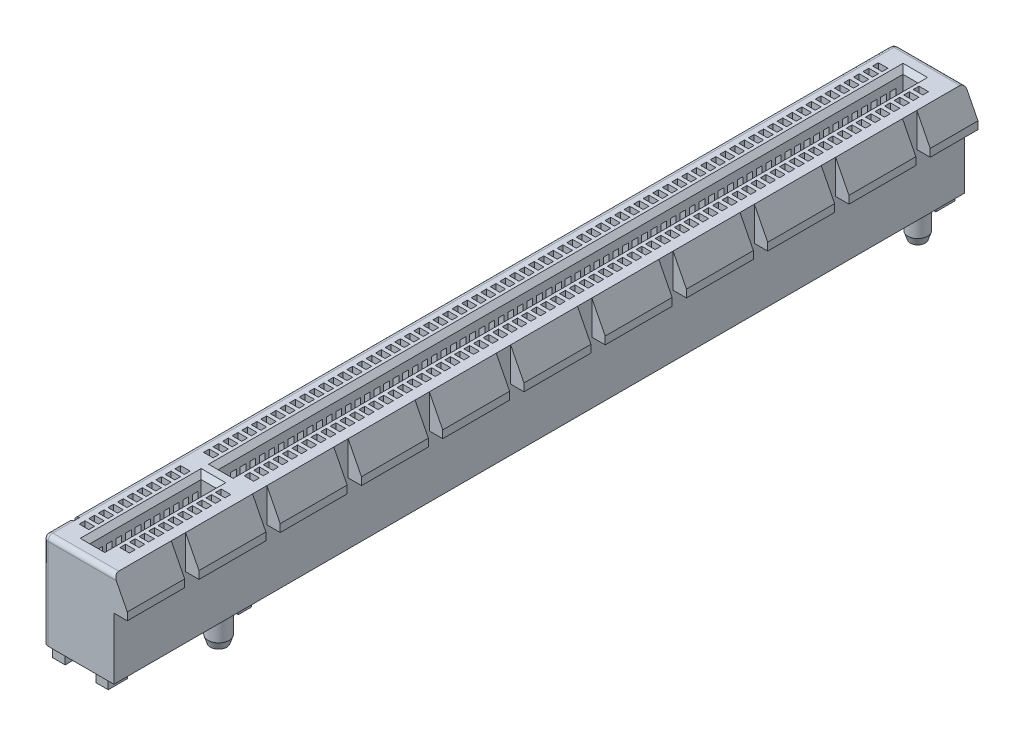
SolidWorks part; units mm, degrees
ref_plane "Front" through (0, 0, 0) normal (0, 0, 1) x (1, 0, 0)
ref_plane "Top" through (0, 0, 0) normal (0, 1, 0) x (1, 0, 0)
ref_plane "Right" through (0, 0, 0) normal (1, 0, 0) x (0, 0, -1)
sketch "Sketch1" plane through (0, 0, 0) normal (0, 0, 1) x (1, 0, 0)
  line L0 (-3.7, 0) -> (3.7, 0)
  line L2 (3.7, 10) -> (-3.7, 10)
  line L6 (-3.7, 10) -> (-3.7, 0)
  line L7 (3.7, 10) -> (5.1, 7.25)
  line L8 (5.1, 7.25) -> (5.1, 6.45)
  line L9 (5.1, 6.45) -> (3.7, 6.45)
  line L10 (3.7, 6.45) -> (3.7, 0)
  dimension "D1" = 7.4
  dimension "D2" = 10
  dimension "D7" = 0.8
  dimension "D8" = 5.1
  dimension "D9" = 3.7
  dimension "D10" = 3.55
extrude "Body Extrude" add sketch "Sketch1" along normal blind 89
sketch "Datum Reference" plane through (0, 10, 0) normal (0, 1, 0) x (1, 0, 0)
  line L0 (-3.7, -74.5) -> (5.1, -74.5)
  line L1 (-3.7, -89) -> (-3.7, 0) construction
  line L2 (5.1, -89) -> (5.1, 0) construction
  line L3 (3.7, -89) -> (-3.7, -89) construction
  line L4 (0, -89) -> (0, 0)
  dimension "D1" = 14.5
sketch "Sketch3" plane through (0, 10, 0) normal (0, 1, 0) x (1, 0, 0)
  line L1 (0, -89) -> (0, 0) construction
  line L2 (-3.7, -74.5) -> (5.1, -74.5) construction
  line L3 (-0.785, -87.04) -> (0.785, -87.04)
  line L4 (-0.785, -87.04) -> (-0.785, -75.39)
  line L5 (-0.785, -75.39) -> (0.785, -75.39)
  line L6 (0.785, -87.04) -> (0.785, -75.39)
  line L7 (-0.785, -87.04) -> (0.785, -75.39) construction
  line L8 (-0.785, -75.39) -> (0.785, -87.04) construction
  line L9 (-0.785, -73.61) -> (0.785, -73.61)
  line L10 (-0.785, -73.61) -> (-0.785, -1.96)
  line L11 (-0.785, -1.96) -> (0.785, -1.96)
  line L12 (0.785, -73.61) -> (0.785, -1.96)
  line L13 (-0.785, -73.61) -> (0.785, -1.96) construction
  line L14 (-0.785, -1.96) -> (0.785, -73.61) construction
  line L16 (3.7, 0) -> (-3.7, 0) construction
  point P1 (0, -81.215)
  point P7 (0, -37.785)
  dimension "D1" = 0.89
  dimension "D2" = 1.78
  dimension "D3" = 11.65
  dimension "D4" = 1.96
  dimension "D5" = 1.57
extrude "PCB Slot" cut sketch "Sketch3" against normal offset from surface (7.6 mm away) 4.05
sketch "Sketch4" plane through (0, 10, 0) normal (0, 1, 0) x (1, 0, 0)
  line L1 (1.625, -85.7) -> (2.625, -85.7)
  line L2 (1.625, -85.7) -> (1.625, -86.3)
  line L3 (1.625, -86.3) -> (2.625, -86.3)
  line L4 (2.625, -85.7) -> (2.625, -86.3)
  line L5 (-2.625, -85.7) -> (-1.625, -85.7)
  line L6 (-2.625, -85.7) -> (-2.625, -86.3)
  line L7 (-2.625, -86.3) -> (-1.625, -86.3)
  line L8 (-1.625, -85.7) -> (-1.625, -86.3)
  line L9 (0, -74.5) -> (0, -89) construction
  line L10 (-3.7, -74.5) -> (5.1, -74.5) construction
  line L11 (0, -89) -> (0, 0) construction
  line L12 (1.625, -85.7) -> (2.625, -86.3) construction
  line L14 (2.625, -85.7) -> (1.625, -86.3) construction
  point P15 (2.125, -86)
  dimension "D1" = 11.5
  dimension "D2" = 3.25
  dimension "D3" = 0.6
  dimension "D4" = 5.25
extrude "Pin Holder (Top)" cut sketch "Sketch4" against normal blind 4.75
sketch "Sketch7" plane through (0, 10, 0) normal (0, 1, 0) x (1, 0, 0)
  line L0 (-3.7, -89) -> (-3.7, 0) construction
  line L1 (-1.625, -85.7) -> (-2.625, -85.7) construction
  line L2 (-3.2, -85.7) -> (-3.7, -85.7)
  line L3 (-3.2, -85.7) -> (-3.2, -86.3)
  line L4 (-3.2, -86.3) -> (-3.7, -86.3)
  line L5 (-3.7, -85.7) -> (-3.7, -86.3)
  line L6 (-2.625, -86.3) -> (-1.625, -86.3) construction
  dimension "D1" = 0.5
extrude "Cut-Extrude4" cut sketch "Sketch7" against normal up to surface (4.75 mm away)
ref_plane "Upper Face - 1.4mm" through (0, 8.6, 0) normal (0, 1, 0) x (1, 0, 0)
sketch "Sketch5" plane through (0, 8.6, 0) normal (0, 1, 0) x (1, 0, 0)
  line L0 (2.625, -85.7) -> (1.625, -85.7) construction
  line L1 (2.375, -85.7) -> (0.425, -85.7)
  line L2 (2.375, -85.7) -> (2.375, -86.3)
  line L3 (2.375, -86.3) -> (0.425, -86.3)
  line L4 (-2.375, -85.7) -> (-2.375, -86.3)
  line L5 (-2.625, -86.3) -> (-1.625, -86.3) construction
  line L6 (0, -89) -> (0, 0) construction
  line L7 (0.425, -85.7) -> (0.425, -86.3)
  line L8 (-0.425, -85.7) -> (-0.425, -86.3)
  line L9 (-0.425, -85.7) -> (-2.375, -85.7)
  line L10 (-0.425, -86.3) -> (-2.375, -86.3)
  dimension "D1" = 4.75
  dimension "D2" = 0.85
extrude "Pin Holder (Bottom)" cut sketch "Sketch5" against normal through all
sketch "Sketch6" plane through (0, 0, 86.3) normal (0, 0, -1) x (-1, 0, 0)
  line L0 (0, 0) -> (0, 10) construction
  line L1 (3.7, 10) -> (-5.1, 10) construction
  line L2 (-1.625, 9.1) -> (-1.3, 8.6)
  line L3 (-1.3, 8.6) -> (-1.625, 8.6)
  line L4 (-1.625, 8.6) -> (-1.625, 9.1)
  line L5 (-2.625, 5.25) -> (-2.375, 4.7)
  line L6 (-2.625, 5.25) -> (-2.375, 5.25)
  line L7 (-2.375, 5.25) -> (-2.375, 4.7)
  line L8 (2.625, 5.25) -> (2.375, 5.25) construction
  line L9 (2.375, 5.25) -> (2.375, 4.7)
  line L10 (2.625, 5.25) -> (2.375, 5.25)
  line L11 (2.625, 5.25) -> (2.375, 4.7)
  line L12 (-0.785, 8.6) -> (-1.625, 8.6)
  line L13 (-1.625, 8.6) -> (-1.625, 10)
  line L14 (-1.625, 10) -> (-2.625, 10)
  line L15 (-2.625, 10) -> (-2.625, 5.25)
  line L16 (-2.625, 5.25) -> (-2.375, 5.25)
  line L17 (-2.375, 5.25) -> (-2.375, 0)
  line L18 (-2.375, 0) -> (-0.425, 0)
  line L19 (-0.425, 0) -> (-0.425, 2.4)
  line L20 (-0.425, 2.4) -> (-0.785, 2.4)
  line L21 (-0.785, 2.4) -> (-0.785, 8.6)
  line L22 (-0.785, 8.6) -> (-1.625, 8.6) construction
  line L23 (-1.625, 8.6) -> (-1.625, 10) construction
  line L24 (-1.625, 10) -> (-2.625, 10) construction
  line L25 (-2.625, 10) -> (-2.625, 5.25) construction
  line L26 (-2.625, 5.25) -> (-2.375, 5.25) construction
  line L27 (-2.375, 5.25) -> (-2.375, 0) construction
  line L28 (-2.375, 0) -> (-0.425, 0) construction
  line L29 (-0.425, 0) -> (-0.425, 2.4) construction
  line L30 (-0.425, 2.4) -> (-0.785, 2.4) construction
  line L31 (-0.785, 2.4) -> (-0.785, 8.6) construction
  line L32 (1.625, 8.6) -> (1.625, 9.1)
  line L33 (1.3, 8.6) -> (1.625, 8.6)
  line L34 (1.625, 9.1) -> (1.3, 8.6)
  dimension "D1" = 0
  dimension "D2" = 0.9
  dimension "D3" = 1.3
  dimension "D4" = 5.3
extrude "Pin Holder Chamfer" cut sketch "Sketch6" along normal up to surface (0.6 mm away)
pattern_linear "Pin Pattern" count 84 spacing 1 along (0, 0, -1) of "Pin Holder (Top)", "Pin Holder Chamfer", "Pin Holder (Bottom)"
chamfer "Insert Chamfer (0.5mmx45)" distance 0.5 angle 45 8 edges at (0, 10, 73.61) (0.785, 10, 37.785) (0, 10, 1.96) (-0.785, 10, 37.785) (0.785, 10, 81.215) (0, 10, 75.39) (-0.785, 10, 81.215) (0, 10, 87.04)
sketch "Sketch8" plane through (0, 0, 0) normal (0, -1, 0) x (1, 0, 0)
  line L0 (0, 89) -> (0, 0) construction
  line L1 (-3.7, 89) -> (3.7, 89) construction
  line L2 (-2.375, 85.7) -> (-2.375, 86.3) construction
  line L3 (0.755, 73.55) -> (-0.755, 73.55)
  line L5 (0.425, 73.3) -> (2.375, 73.3) construction
  arc A0 (0.755, 73.55) -> (-0.755, 73.55) centre (0, 74.35) ccw
  circle A1 centre (0, 1.2) radius 1.025
  point P9 (-2.375, 86)
  dimension "D1" = 2.2
  dimension "D3" = 2.05
  dimension "D4" = 73.15
  dimension "D2" = 11.65
  dimension "D5" = 0.25
extrude "Locator Pins" add sketch "Sketch8" along normal blind 5.4
chamfer "Locator Pin Chanfer (0.25mmx0.75mm)" distance 0.75 distance2 0.25 2 edges at (0, -5.4, 0.175) (0, -5.4, 75.45)
sketch "Sketch9" plane through (0, 0, 0) normal (0, -1, 0) x (1, 0, 0)
  line L0 (0, 0) -> (0, 89) construction
  line L1 (-2.9, 88.8) -> (-1.6, 88.8)
  line L2 (-2.9, 88.8) -> (-2.9, 86.8)
  line L3 (-2.9, 86.8) -> (-1.6, 86.8)
  line L4 (-1.6, 88.8) -> (-1.6, 86.8)
  line L5 (-2.9, 75.2) -> (-1.6, 75.2)
  line L6 (-2.9, 75.2) -> (-2.9, 73.8)
  line L7 (-2.9, 73.8) -> (-1.6, 73.8)
  line L8 (-1.6, 75.2) -> (-1.6, 73.8)
  line L9 (-2.9, 2.2) -> (-1.6, 2.2)
  line L10 (-2.9, 2.2) -> (-2.9, 0.2)
  line L11 (-2.9, 0.2) -> (-1.6, 0.2)
  line L12 (-1.6, 2.2) -> (-1.6, 0.2)
  line L13 (-3.7, 89) -> (3.7, 89) construction
  line L14 (1.6, 2.2) -> (1.6, 0.2)
  line L15 (2.9, 0.2) -> (1.6, 0.2)
  line L16 (2.9, 2.2) -> (2.9, 0.2)
  line L17 (2.9, 2.2) -> (1.6, 2.2)
  line L18 (1.6, 75.2) -> (1.6, 73.8)
  line L19 (2.9, 73.8) -> (1.6, 73.8)
  line L20 (2.9, 75.2) -> (2.9, 73.8)
  line L21 (2.9, 75.2) -> (1.6, 75.2)
  line L22 (1.6, 88.8) -> (1.6, 86.8)
  line L23 (2.9, 86.8) -> (1.6, 86.8)
  line L24 (2.9, 88.8) -> (2.9, 86.8)
  line L25 (2.9, 88.8) -> (1.6, 88.8)
  line L27 (-3.7, 0) -> (3.7, 0) construction
  line L30 (-2.375, 86.3) -> (-0.425, 86.3) construction
  line L31 (-0.425, 75.7) -> (-2.375, 75.7) construction
  line L32 (-2.375, 73.3) -> (-0.425, 73.3) construction
  dimension "D1" = 0.2
  dimension "D2" = 5.8
  dimension "D3" = 2
  dimension "D4" = 0.5
  dimension "D5" = 0.5
  dimension "D6" = 0.5
  dimension "D7" = 1.3
extrude "Stand-Offs" add sketch "Sketch9" along normal blind 1
fillet "Edge Fillet (0.5mm)" radius 0.5 6 edges at (-3.7, 5, 0) (-3.7, 5, 89) (-3.7, 10, 87.65) (-3.7, 10, 42.85) (0, 10, 0) (0, 10, 89)
sketch "Sketch2" plane through (0, 10, 0) normal (0, 1, 0) x (1, 0, 0)
  line L0 (5.1, -89) -> (5.1, 0) construction
  line L1 (5.1, -73) -> (3.7, -73)
  line L2 (5.1, -73) -> (5.1, -74.5)
  line L3 (5.1, -74.5) -> (3.7, -74.5)
  line L4 (3.7, -73) -> (3.7, -74.5)
  line L5 (3.7, -88.5) -> (3.7, -0.5) construction
  line L6 (5.1, -57.5) -> (3.7, -57.5)
  line L7 (5.1, -56) -> (5.1, -57.5)
  line L8 (3.9545, -89) -> (-3.2, -89) construction
  line L9 (5.1, -66) -> (3.7, -66)
  line L10 (5.1, -64.5) -> (5.1, -66)
  line L11 (5.1, -64.5) -> (3.7, -64.5)
  line L12 (3.7, -64.5) -> (3.7, -66)
  line L13 (5.1, -83) -> (3.7, -83)
  line L14 (5.1, -81.5) -> (5.1, -83)
  line L15 (5.1, -81.5) -> (3.7, -81.5)
  line L16 (3.7, -81.5) -> (3.7, -83)
  line L17 (5.1, -56) -> (3.7, -56)
  line L18 (3.7, -56) -> (3.7, -57.5)
  line L19 (5.1, -49) -> (3.7, -49)
  line L20 (5.1, -47.5) -> (5.1, -49)
  line L21 (5.1, -47.5) -> (3.7, -47.5)
  line L22 (3.7, -47.5) -> (3.7, -49)
  line L23 (5.1, -40.5) -> (3.7, -40.5)
  line L24 (5.1, -39) -> (5.1, -40.5)
  line L25 (5.1, -39) -> (3.7, -39)
  line L26 (3.7, -39) -> (3.7, -40.5)
  line L27 (5.1, -32) -> (3.7, -32)
  line L28 (5.1, -30.5) -> (5.1, -32)
  line L29 (5.1, -30.5) -> (3.7, -30.5)
  line L30 (3.7, -30.5) -> (3.7, -32)
  line L31 (5.1, -23.5) -> (3.7, -23.5)
  line L32 (5.1, -22) -> (5.1, -23.5)
  line L33 (5.1, -22) -> (3.7, -22)
  line L34 (3.7, -22) -> (3.7, -23.5)
  line L35 (5.1, -15) -> (3.7, -15)
  line L36 (5.1, -13.5) -> (5.1, -15)
  line L37 (5.1, -13.5) -> (3.7, -13.5)
  line L38 (3.7, -13.5) -> (3.7, -15)
  line L39 (5.1, -6.5) -> (3.7, -6.5)
  line L40 (5.1, -5) -> (5.1, -6.5)
  line L41 (5.1, -5) -> (3.7, -5)
  line L42 (3.7, -5) -> (3.7, -6.5)
  dimension "D1" = 14.5
  dimension "D2" = 2
  dimension "D3" = 1.5
  dimension "D4" = 7
  dimension "D5" = 9
  dimension "D6" = 7
extrude "Side Slots" cut sketch "Sketch2" against normal up to surface (3.55 mm away)
